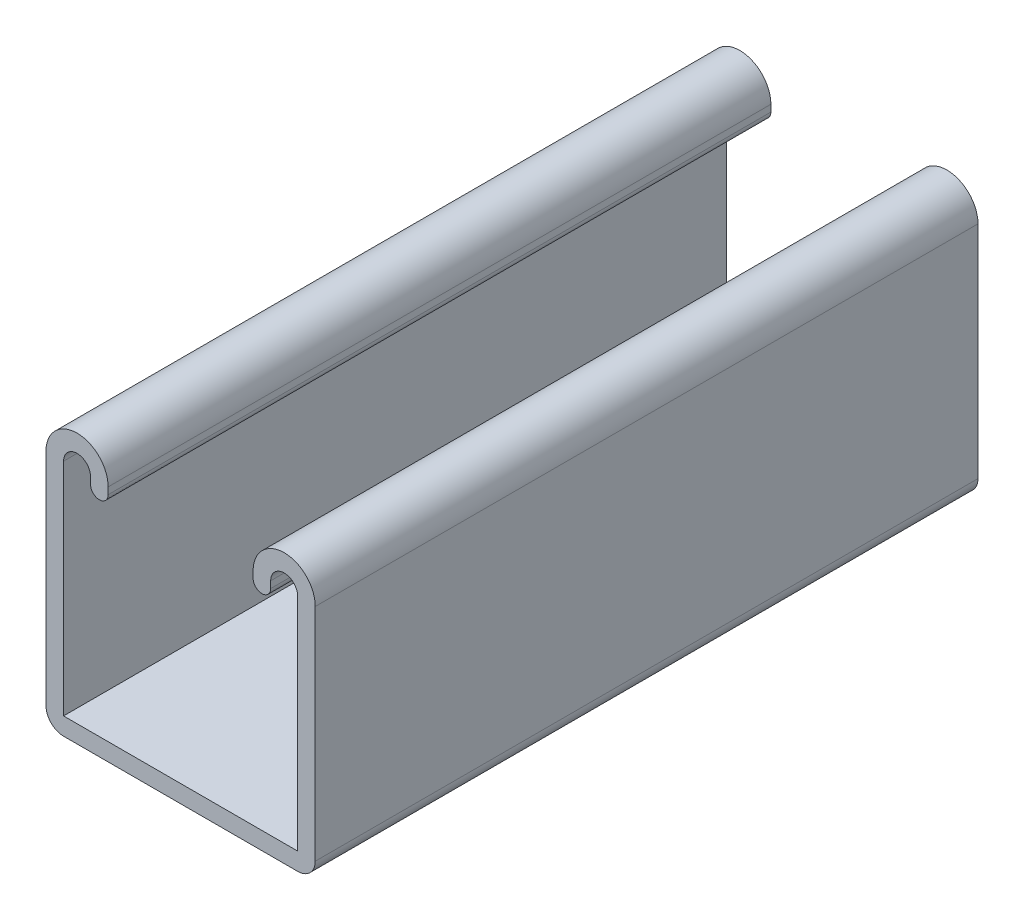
SolidWorks part; units mm, degrees
ref_plane "Plane1" through (0, 0, 0) normal (0, 0, 1) x (1, 0, 0)
ref_plane "Plane2" through (0, 0, 0) normal (0, 1, 0) x (1, 0, 0)
ref_plane "Plane3" through (0, 0, 0) normal (1, 0, 0) x (0, 0, -1)
sketch "Sketch1" plane through (0, 0, 0) normal (0, 0, 1) x (1, 0, 0)
  line L0 (-20.6375, 18.4785) -> (-20.6375, -15.3416)
  line L1 (-17.9451, -18.034) -> (17.9451, -18.034)
  line L2 (20.6375, -15.3416) -> (20.6375, 18.4785)
  line L3 (11.1125, 18.4785) -> (11.1125, 17.4434)
  line L4 (-11.1125, 18.4785) -> (-11.1125, 17.4434)
  line L5 (-13.8049, 18.4785) -> (-13.8049, 17.4434)
  line L6 (-17.9451, 18.4785) -> (-17.9451, -15.3416)
  line L7 (-17.9451, -15.3416) -> (17.9451, -15.3416)
  line L8 (17.9451, -15.3416) -> (17.9451, 18.4785)
  line L9 (13.8049, 18.4785) -> (13.8049, 17.4434)
  line L10 (-25.4, 23.241) -> (25.4, 23.241) construction
  line L11 (-12.8524, 16.0972) -> (12.8524, 16.0972) construction
  arc A0 (20.6375, 18.4785) -> (11.1125, 18.4785) centre (15.875, 18.4785) ccw
  arc A1 (-20.6375, 18.4785) -> (-11.1125, 18.4785) centre (-15.875, 18.4785) cw
  arc A2 (-17.9451, -18.034) -> (-20.6375, -15.3416) centre (-17.9451, -15.3416) cw
  arc A3 (17.9451, -18.034) -> (20.6375, -15.3416) centre (17.9451, -15.3416) ccw
  arc A4 (-17.9451, 18.4785) -> (-13.8049, 18.4785) centre (-15.875, 18.4785) cw
  arc A5 (17.9451, 18.4785) -> (13.8049, 18.4785) centre (15.875, 18.4785) ccw
  arc A6 (11.1125, 17.4434) -> (13.8049, 17.4434) centre (12.4587, 17.4434) ccw
  arc A7 (-11.1125, 17.4434) -> (-13.8049, 17.4434) centre (-12.4587, 17.4434) cw
  dimension "D1" = 2.6924
  dimension "D3" = 20.6375
  dimension "Width" = 41.275
  dimension "D5" = 18.034
  dimension "D6" = 9.525
  dimension "D7" = 22.225
  dimension "D8" = 23.241
  dimension "D9" = 7.1437
  dimension "gauge" = 2.6924
extrude "Base-Extrude" add sketch "Sketch1" along normal blind 101.6
other "Hole1"
sketch "Sketch3" plane through (0, -18.034, 0) normal (0, -1, 0) x (1, 0, 0)
  circle A0 centre (0, 23.8125) radius 7.1438
  dimension "D1" = 14.2875
  dimension "D2" = 23.8125
pattern_linear "LPattern1" count 2 spacing 47.625 along (0, 0, 1) of "Hole1"
equation "\"D3@Sketch1\" = \"Width@Sketch1\" / 2"
equation "\"D7@Sketch1\" = \"Width@Sketch1\" - 2 * \"D6@Sketch1\""
equation "\"D1@Sketch1\" = \"gauge@Sketch1\""
equation "\"D1@LPattern1\" = \"D1@Base-Extrude\" / \"D3@LPattern1\""
